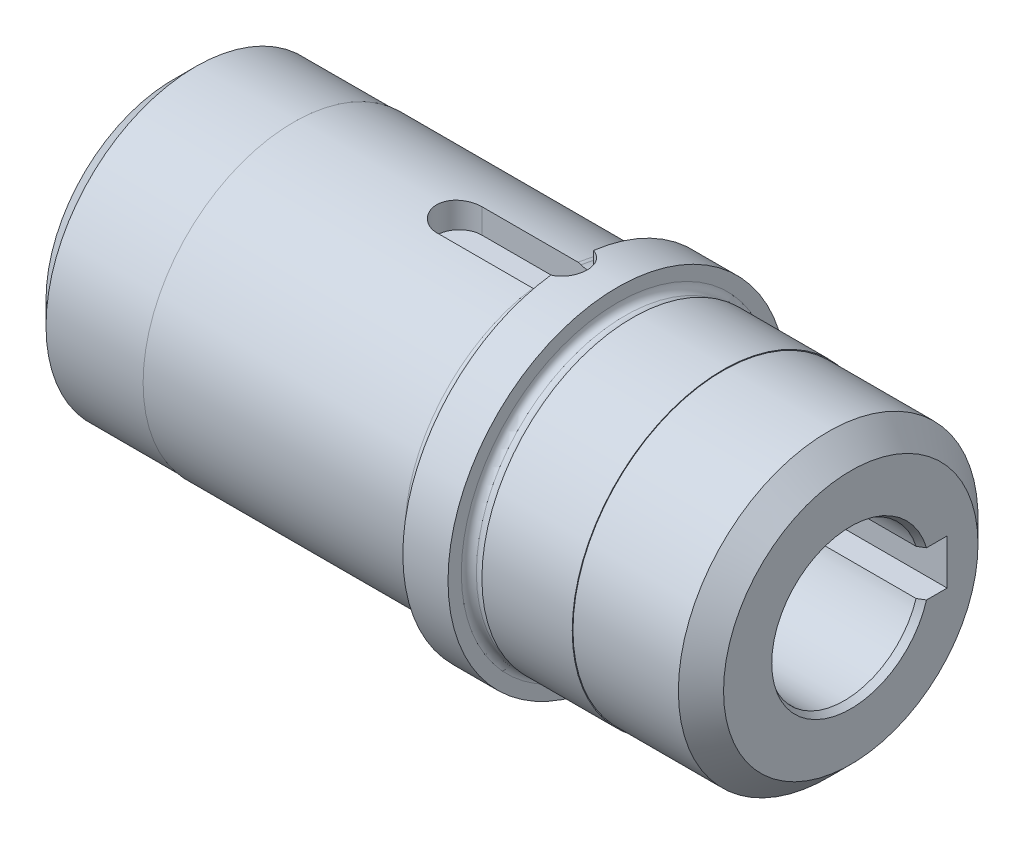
SolidWorks part; units mm, degrees
ref_plane "Face" through (0, 0, 0) normal (0, 0, 1) x (1, 0, 0)
ref_plane "Dessus" through (0, 0, 0) normal (0, 1, 0) x (1, 0, 0)
ref_plane "Droite" through (0, 0, 0) normal (1, 0, 0) x (0, 0, -1)
sketch "Esquisse1" plane through (0, 0, 0) normal (0, 0, 1) x (1, 0, 0)
  line L0 (0, 19.9) -> (16, 19.9)
  line L1 (0, 0) -> (90, 0)
  line L2 (0, 0) -> (0, 19.9)
  line L3 (16, 20) -> (50.7607, 20)
  line L4 (90, 0) -> (90, 19.9)
  line L5 (16, 19.9) -> (16, 20)
  line L6 (61, 20) -> (73, 20)
  line L7 (0, 0) -> (98.6902, 0) construction
  line L8 (53, 20.7321) -> (53, 22.5)
  line L9 (53, 22.5) -> (59, 22.5)
  line L10 (59, 20.7321) -> (59, 22.5)
  line L12 (73, 20) -> (73, 19.9)
  line L13 (73, 19.9) -> (90, 19.9)
  arc A0 (52, 19.7321) -> (51.1738, 19.9107) centre (52, 21.7321) cw
  arc A1 (53, 20.7321) -> (52, 19.7321) centre (52, 20.7321) cw
  arc A2 (50.7607, 20) -> (51.1738, 19.9107) centre (50.7607, 19) cw
  arc A3 (60, 19.7321) -> (61, 20) centre (60, 21.7321) ccw
  arc A4 (60, 19.7321) -> (59, 20.7321) centre (60, 20.7321) cw
  point P16 (53, 20)
  point P19 (51, 20)
  point P25 (59, 20)
  dimension "D8" = 2
  dimension "D9" = 1
  dimension "D11" = 2
  dimension "D12" = 1
  dimension "D1" = 16
  dimension "D2" = 19.9
  dimension "D3" = 2
  dimension "D4" = 20
  dimension "D5" = 22.5
  dimension "D6" = 6
  dimension "D7" = 53
  dimension "D10" = 2
  dimension "D13" = 12
  dimension "D14" = 90
revolve "Base-Révolution" add sketch "Esquisse1" angle 360 about L7
chamfer "Chanfrein1" distance 3 angle 45
sketch "Esquisse2" plane through (90, 0, 0) normal (1, 0, 0) x (0, 0, -1)
  line L1 (9.5394, 3) -> (12.8, 3)
  line L3 (9.5394, -3) -> (12.8, -3)
  line L4 (12.8, 3) -> (12.8, -3)
  arc A0 (9.5394, 3) -> (9.5394, -3) centre (0, 0) ccw
  point P1 (12.8, 0)
  dimension "D1" = 10
  dimension "D2" = 6
  dimension "D3" = 12.8
extrude "Enlèv. mat.-Extru.1" cut sketch "Esquisse2" against normal through all
chamfer "Chanfrein2" distance 0.5 angle 60
chamfer "Chanfrein3" distance 0.5 angle 60
ref_plane "Plan1" through (0, 16.5, 0) normal (0, 1, 0) x (-1, 0, 0)
sketch "Esquisse3" plane through (0, 16.5, 0) normal (0, 1, 0) x (-1, 0, 0)
  line L0 (-0.866, 0) -> (-89.134, 0) construction
  line L1 (-38, -3) -> (-52, -3)
  line L2 (-38, 3) -> (-52, 3)
  line L3 (-90, 16.9) -> (-90, -16.9) construction
  arc A0 (-38, -3) -> (-38, 3) centre (-38, 0) ccw
  arc A1 (-52, 3) -> (-52, -3) centre (-52, 0) ccw
  dimension "D2" = 14
  dimension "D3" = 38
  dimension "D1" = 6
extrude "Enlèv. mat.-Extru.2" cut sketch "Esquisse3" along normal through all
